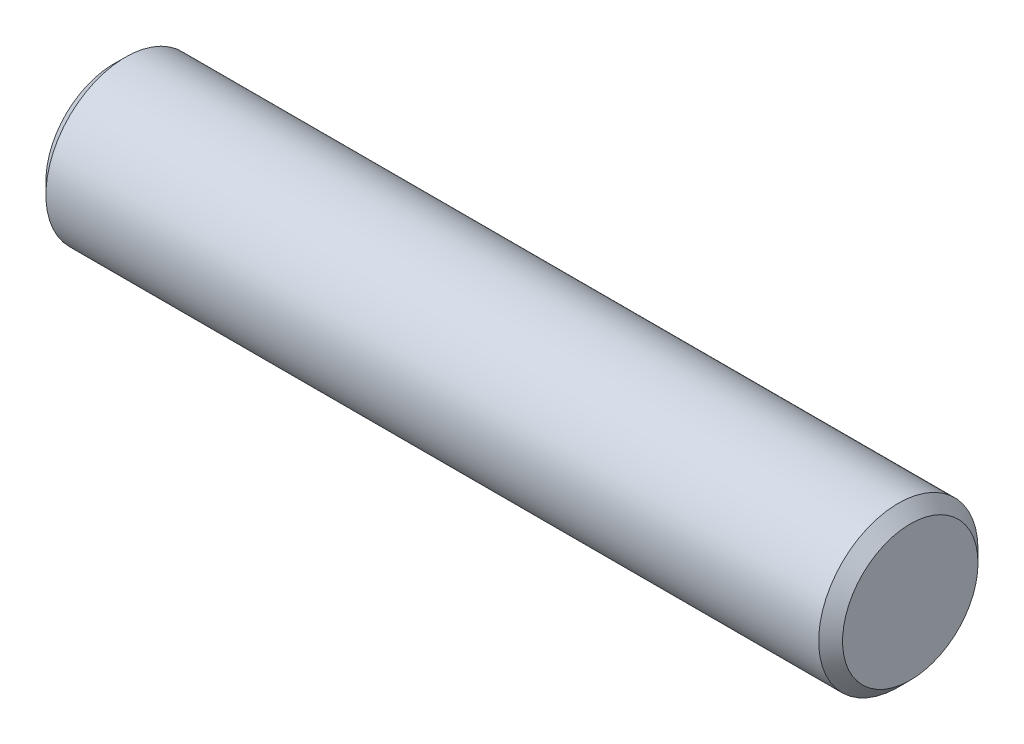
SolidWorks part; units mm, degrees
ref_plane "Plane1" through (0, 0, 0) normal (0, 0, 1) x (1, 0, 0)
ref_plane "Plane2" through (0, 0, 0) normal (0, 1, 0) x (1, 0, 0)
ref_plane "Plane3" through (0, 0, 0) normal (1, 0, 0) x (0, 0, -1)
sketch "BodySke" plane through (0, 0, 0) normal (0, 0, 1) x (1, 0, 0)
  line L0 (83, 15.875) -> (83, -6.35) construction
  line L1 (2.5, 15.875) -> (2.5, -3.175) construction
  line L2 (95, 6.35) -> (95, 3.175) construction
  line L10 (0, 10) -> (100, 10)
  line L12 (100, 10) -> (100, 0)
  line L13 (100, 0) -> (0, 0)
  line L14 (-3.175, 0) -> (107.95, 0) construction
  line L18 (0, 10) -> (0, 0)
  dimension "Diameter" = 20
  dimension "Minor_dia" = 17
  dimension "Length" = 100
  dimension "Advance" = 2.5
  dimension "Thread_max" = 95
revolve "BaseBody" add sketch "BodySke" angle 360 about L14
chamfer "Chamfer1" distance 1.5 angle 45 2 edges at (100, 0, 10) (0, 0, 10)
sketch "ThdSchSke" plane through (0, 0, 0) normal (0, 0, 1) x (1, 0, 0)
  line L0 (1.0503, -8.5) -> (0, -10)
  line L1 (1.0503, -8.5) -> (2.1006, -10)
  line L2 (2.1006, -10) -> (2.1006, -12.5)
  line L3 (-3.175, 0) -> (5.1513, 0) construction
  line L4 (0, 10) -> (0, -10) construction
  line L5 (2.1006, -12.5) -> (0, -12.5)
  line L6 (0, -12.5) -> (0, -10)
  dimension "Thread_minor" = 17
  dimension "Diameter" = 20
  dimension "SideAngle" = 55
  dimension "VeeAngle" = 70
  dimension "Overcut" = 25
revolve "ThreadSchematic" [suppressed] cut sketch "ThdSchSke" angle 360 about L3
pattern_linear "ThdSchPat" [suppressed]
equation "\"Thread_minor@ThreadCosmetic\" = \"Minor_dia@BodySke\""
equation "\"Chamfer@Chamfer1\" =  ( \"Diameter@BodySke\" - \"Minor_dia@BodySke\" ) / 2"
equation "\"Thread_minor@ThdSchSke\" = \"Minor_dia@BodySke\""
equation "\"Diameter@ThdSchSke\" = \"Diameter@BodySke\""
equation "\"Overcut@ThdSchSke\" = \"Diameter@BodySke\" * 1.25"
equation "\"Num_threads@ThdSchPat\" = int( (\"Thread_max@BodySke\" - \"Advance@BodySke\" ) / \"Advance@BodySke\" + 0.999 ) + 1"
equation "\"Advance@ThdSchPat\" = \"Thread_max@BodySke\" /  ( \"Num_threads@ThdSchPat\" - 1 ) 'relax it"
equation "\"Num_threads@ThdSchPat\" = \"Num_threads@ThdSchPat\" - sgn( \"Num_threads@ThdSchPat\" - 1 ) '---chamfered tips only---"
